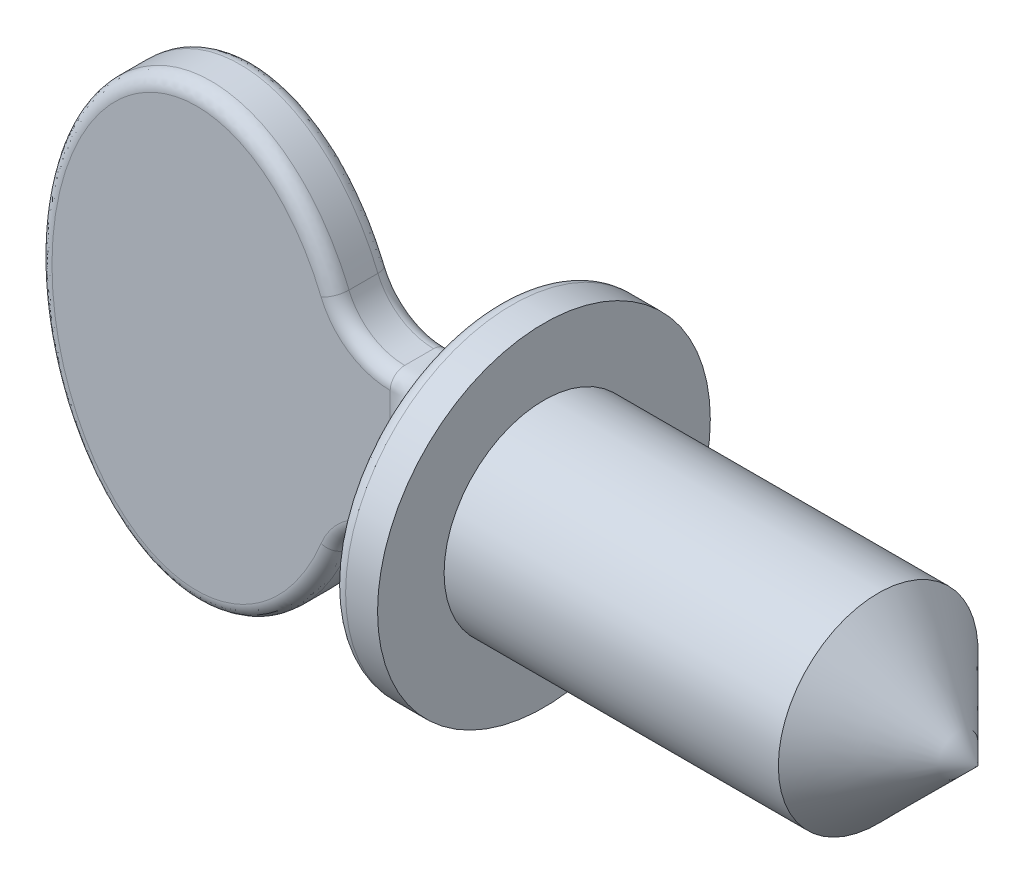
SolidWorks part; units mm, degrees
ref_plane "Front Plane" through (0, 0, 0) normal (0, 0, 1) x (1, 0, 0)
ref_plane "Top Plane" through (0, 0, 0) normal (0, 1, 0) x (1, 0, 0)
ref_plane "Right Plane" through (0, 0, 0) normal (1, 0, 0) x (0, 0, -1)
other "Configuration Table"
sketch "layout" plane through (0, 0, 0) normal (0, 0, 1) x (1, 0, 0)
  line L0 (0, 0) -> (13.208, 0) construction
  line L1 (5.588, 2.921) -> (5.588, -2.921)
  line L2 (3.3976, 1.3123) -> (4.8921, 1.3123) construction
  line L3 (5.588, 2.921) -> (4.7897, 2.921)
  line L4 (4.7897, 2.921) -> (4.7897, 3.2655) construction
  line L5 (4.2865, 1.706) -> (4.2865, 0)
  line L6 (4.2865, 1.706) -> (3.3355, 0.7551) construction
  line L7 (13.208, 1.7526) -> (13.208, 0)
  line L8 (3.3976, 1.3123) -> (3.3976, -1.3123)
  line L9 (13.208, 1.7526) -> (5.588, 1.7526)
  arc A0 (3.3976, 1.3123) -> (2.4197, 1.9685) centre (3.3976, 2.3692) cw
  arc A1 (4.7897, 2.921) -> (4.2865, 1.706) centre (3.0715, 2.921) cw
  arc A2 (3.3976, -1.3123) -> (2.4197, -1.9685) centre (3.3976, -2.3692) ccw
  ellipse E0 centre (0, 0) end of major axis (0, 3.937) minor radius 2.794 (2.4197, 1.9685) -> (2.4197, -1.9685) ccw
sketch "Sketch3" plane through (0, 0, 0) normal (0, 0, 1) x (1, 0, 0)
  line L0 (3.3976, 1.3123) -> (3.3976, -1.3123) construction
  line L1 (3.3976, 1.3123) -> (3.3976, -1.3123)
  arc A0 (3.3976, -1.3123) -> (2.4197, -1.9685) centre (3.3976, -2.3692) ccw construction
  arc A1 (2.4197, 1.9685) -> (3.3976, 1.3123) centre (3.3976, 2.3692) ccw construction
  arc A2 (3.3976, -1.3123) -> (2.4197, -1.9685) centre (3.3976, -2.3692) ccw
  arc A3 (2.4197, 1.9685) -> (3.3976, 1.3123) centre (3.3976, 2.3692) ccw
  ellipse E0 centre (0, 0) end of major axis (0, 3.937) minor radius 2.794 (2.4197, 1.9685) -> (2.4197, -1.9685) ccw construction
  ellipse E1 centre (0, 0) end of major axis (0, 3.937) minor radius 2.794 (2.4197, 1.9685) -> (2.4197, -1.9685) ccw
extrude "Extrude1" add sketch "Sketch3" along normal mid plane 1.016
fillet "Fillet1" radius 0.254 6 edges at (2.8088, 1.4916, -0.508) (2.8088, -1.4916, -0.508) (2.8088, 1.4916, 0.508) (2.8088, -1.4916, 0.508) (-2.794, 0, -0.508) (-2.794, 0, 0.508)
sketch "Sketch4" plane through (0, 0, 0) normal (0, 0, 1) x (1, 0, 0)
  line L0 (13.208, 1.7526) -> (13.208, 0) construction
  line L1 (13.208, 1.7526) -> (5.588, 1.7526) construction
  line L2 (5.588, 2.921) -> (5.588, -2.921) construction
  line L3 (5.588, 2.921) -> (4.7897, 2.921) construction
  line L4 (4.2865, 1.706) -> (4.2865, 0) construction
  line L5 (13.208, 1.7526) -> (13.208, 0) construction
  line L6 (11.4554, 1.7526) -> (5.588, 1.7526)
  line L7 (5.588, 2.921) -> (5.588, 1.7526)
  line L8 (5.588, 2.921) -> (4.7897, 2.921)
  line L9 (4.2865, 1.706) -> (4.2865, 0)
  line L10 (0, 0) -> (16.8942, 0) construction
  line L11 (13.208, 0) -> (4.2865, 0)
  line L12 (13.208, 0) -> (11.4554, 1.7526)
  line L13 (13.208, 0) -> (11.4554, -1.7526) construction
  arc A0 (4.2865, 1.706) -> (4.7897, 2.921) centre (3.0715, 2.921) ccw construction
  arc A1 (4.2865, 1.706) -> (4.7897, 2.921) centre (3.0715, 2.921) ccw
  dimension "D1" = 90
revolve "Revolve1" add sketch "Sketch4" angle 360 about L10
loft "Loft1" add
fillet "Fillet2" radius 0.254 1 edges at (4.7897, 0, 2.921)
sketch "Sketch5" plane through (0, 0, 0) normal (0, 1, 0) x (1, 0, 0)
  line L0 (10.9099, 2.2981) -> (11.4554, 2.2981)
  line L1 (11.4554, 2.2981) -> (11.4554, 1.7526)
  line L2 (11.4554, 1.7526) -> (11.1826, 1.2802)
  line L3 (11.1826, 1.2802) -> (10.9099, 1.7526)
  line L5 (10.9099, 1.7526) -> (10.9099, 2.2981)
  line L6 (11.4554, -1.7526) -> (11.4554, 1.7526) construction
  line L7 (-3.6147, 0) -> (14.1406, 0) construction
  line L8 (11.4554, 1.7526) -> (5.588, 1.7526) construction
revolve "Cut-Revolve10" [suppressed] cut sketch "Sketch5" angle 360 about L7
pattern_linear "LPattern10" [suppressed] count 7 along (1, 0, 0)
equation "\"D4@layout\" = \"Head Height@layout\" / 3 * 2"
equation "\"D5@layout\" = \"Head Width@layout\" / 3"
equation "\"D6@layout\" = \"Head Width@layout\" / 2"
equation "\"D7@layout\" = \"D5@layout\" * 1.3"
equation "\"D8@layout\" = \"D4@layout\"  / 7"
equation "\"D1@Fillet1\" = \"Head Thickness@Extrude1\" / 4"
equation "\"D1@Fillet2\" = \"D1@Fillet1\""
equation "\"D1@Sketch5\" = ( \"Base Screw Dia@layout\"- \"Minor Dia@Cosmetic Thread1\" )  / 2"
equation "\"D1@LPattern10\" = int((\"Length@layout\"-\"Base Screw Dia@layout\"/2)/\"Advance@LPattern10\")"
